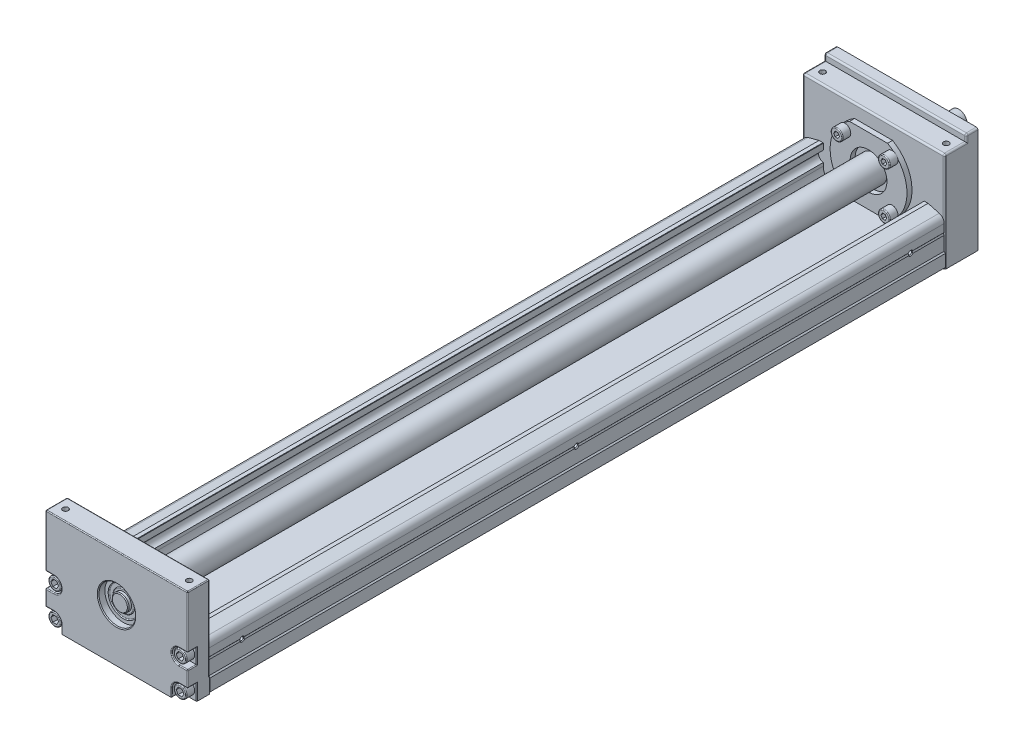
SolidWorks part; units mm, degrees
ref_plane "前视基准面" through (0, 0, 0) normal (0, 0, 1) x (1, 0, 0)
ref_plane "上视基准面" through (0, 0, 0) normal (0, 1, 0) x (1, 0, 0)
ref_plane "右视基准面" through (0, 0, 0) normal (1, 0, 0) x (0, 0, -1)
sketch "草图1" plane through (0, 0, 0) normal (0, 0, 1) x (1, 0, 0)
  line L0 (0, 0) -> (0, 14.97) construction
  line L1 (-11, 0.5) -> (11, 0.5)
  line L2 (11, 0.5) -> (11, 0)
  line L3 (11, 0) -> (33, 0) construction
  line L4 (33, 0) -> (33, 0.5)
  line L5 (33, 0.5) -> (41.5, 0.5)
  line L6 (43, 2) -> (43, 9.25) construction
  line L7 (43, 9.25) -> (42.25, 10)
  line L8 (42.25, 10) -> (42.25, 24.345)
  line L9 (39.2853, 28.2087) -> (32.6, 30)
  line L10 (32.6, 30) -> (30.1, 30) construction
  line L11 (30.1, 30) -> (30.1, 17.9)
  line L12 (30.1, 30) -> (30.1, 30.15)
  line L13 (13, 9.9) -> (-13, 9.9)
  line L14 (41.5, 0.5) -> (43, 2)
  line L15 (-41.5, 0.5) -> (-43, 2)
  line L16 (30.1, 30.15) -> (32.0402, 30.15)
  line L17 (-30.1, 30) -> (-30.1, 17.9)
  line L18 (-32.6, 30) -> (-30.1, 30) construction
  line L19 (-39.2853, 28.2087) -> (-32.6, 30)
  line L20 (-42.25, 10) -> (-42.25, 24.345)
  line L21 (-43, 9.25) -> (-42.25, 10)
  line L22 (-43, 2) -> (-43, 9.25) construction
  line L23 (-33, 0.5) -> (-41.5, 0.5)
  line L24 (-33, 0) -> (-33, 0.5)
  line L25 (-11, 0) -> (-33, 0) construction
  line L26 (-11, 0.5) -> (-11, 0)
  line L27 (13, 9.9) -> (22.1, 9.9)
  line L28 (32.0402, 30.15) -> (32.6, 30)
  line L29 (-13, 9.9) -> (-22.1, 9.9)
  line L30 (43, 9.25) -> (43.15, 9.1)
  line L31 (43.15, 9.1) -> (43.15, 2.15)
  line L32 (43.15, 2.15) -> (43, 2)
  line L33 (33, 0) -> (33, -0.5)
  line L34 (33, -0.5) -> (11, -0.5)
  line L35 (11, -0.5) -> (11, 0)
  line L36 (-11, -0.5) -> (-11, 0)
  line L37 (-33, -0.5) -> (-11, -0.5)
  line L38 (-33, 0) -> (-33, -0.5)
  line L39 (-43.15, 2.15) -> (-43, 2)
  line L40 (-43.15, 9.1) -> (-43.15, 2.15)
  line L41 (-43, 9.25) -> (-43.15, 9.1)
  line L42 (-30.1, 30) -> (-30.1, 30.15)
  line L43 (-30.1, 30.15) -> (-32.0402, 30.15)
  line L44 (-32.0402, 30.15) -> (-32.6, 30)
  arc A0 (42.25, 24.345) -> (39.2853, 28.2087) centre (38.25, 24.345) ccw
  arc A1 (-22.1, 9.9) -> (-30.1, 17.9) centre (-22.1, 17.9) cw
  arc A2 (22.1, 9.9) -> (30.1, 17.9) centre (22.1, 17.9) ccw
  arc A3 (-42.25, 24.345) -> (-39.2853, 28.2087) centre (-38.25, 24.345) cw
  point P9 (43, 0.5)
  point P24 (0, 0.5)
  point P25 (0, 9.9)
  point P40 (-43, 0.5)
  dimension "D16" = 4
  dimension "D17" = 13
  dimension "D15" = 8
  dimension "D1" = 0.5
  dimension "D2" = 0.5
  dimension "D3" = 43
  dimension "D4" = 42.25
  dimension "D5" = 2.5
  dimension "D6" = 30
  dimension "D7" = 15
  dimension "D8" = 9.4
  dimension "D9" = 22
  dimension "D10" = 11
  dimension "D11" = 10
  dimension "D12" = 45
  dimension "D13" = 30.1
  dimension "D14" = 13
  dimension "D19" = 22.1
  dimension "D20" = 22.1
  dimension "D21" = 0.5
  dimension "D22" = 0.15
  dimension "D23" = 0.15
extrude "总长" add sketch "草图1" along normal blind 440
sketch "草图2" plane through (0, 0, 0) normal (0, 0, -1) x (-1, 0, 0)
  line L0 (-33.1974, 23) -> (30.685, 23) construction
  line L1 (0, 0) -> (0, 24.2172) construction
  line L2 (-29.7, 23) -> (-31.9451, 25.2451) construction
  line L4 (-22.1, 9.9) -> (22.1, 9.9) construction
  line L5 (-30.1, 30.15) -> (-30.1, 17.9) construction
  line L6 (-32.8, 22.7) -> (-32.8, 23.3)
  line L7 (-32.6, 23.5) -> (-32.3495, 23.5)
  line L8 (-29.6116, 22.9116) -> (-32.6, 23.3) construction
  line L9 (-32.6, 23.3) -> (-32.8841, 23.3369) construction
  line L10 (-32.6, 22.5) -> (-32.3495, 22.5)
  line L11 (32.6, 22.5) -> (32.3495, 22.5)
  line L12 (32.8, 22.7) -> (32.8, 23.3)
  line L13 (32.6, 23.5) -> (32.3495, 23.5)
  circle A0 centre (-29.7, 23) radius 3.175 construction
  arc A1 (-26.3128, 23) -> (-32.9104, 23) centre (-29.6116, 22.9116) ccw construction
  arc A2 (-26.3128, 23) -> (-32.9104, 23) centre (-29.6116, 23.0884) cw construction
  arc A3 (26.3128, 23) -> (32.9104, 23) centre (29.6116, 23.0884) ccw construction
  arc A4 (26.3128, 23) -> (32.9104, 23) centre (29.6116, 22.9116) cw construction
  arc A5 (-32.3495, 22.5) -> (-32.3495, 23.5) centre (-29.9, 23) ccw
  arc A6 (-32.8, 23.3) -> (-32.6, 23.5) centre (-32.6, 23.3) cw
  arc A7 (-32.8, 22.7) -> (-32.6, 22.5) centre (-32.6, 22.7) ccw
  arc A8 (32.8, 22.7) -> (32.6, 22.5) centre (32.6, 22.7) cw
  arc A9 (32.8, 23.3) -> (32.6, 23.5) centre (32.6, 23.3) ccw
  arc A10 (32.3495, 22.5) -> (32.3495, 23.5) centre (29.9, 23) cw
  point P20 (-31.5649, 24.8649)
  point P21 (-30.1, 26.1753)
  point P22 (-30.1, 25.492)
  point P31 (-32.7983, 23.3258)
  point P33 (-32.8, 23)
  dimension "D2" = 6.35
  dimension "D5" = 6.6
  dimension "D6" = 5
  dimension "D10" = 0.2
  dimension "D1" = 13.1
  dimension "D3" = 59.4
  dimension "D4" = 45
  dimension "D7" = 59.8
  dimension "D8" = 0.5376
  dimension "D9" = 0.6833
  dimension "D11" = 1
  dimension "D12" = 65.6
  dimension "D13" = 0.0865
extrude "预拉滚道" cut sketch "草图2" against normal through all
hole_wizard "cekong" positions "草图4" profile "草图3" tap size "M2.5" standard "GB"
sketch "草图4" plane through (-42.25, 0, 0) normal (-1, 0, 0) x (0, 0, 1)
  line L2 (0, 24.345) -> (0, 10) construction
  point P0 (20, 19)
  dimension "D3" = 19
  dimension "ckdj" = 20
sketch "草图3" plane through (-42.25, 19, 20) normal (0, 1, 0) x (0, 0, 1)
  line L0 (0, 0) -> (0, 6.1159)
  line L1 (0, 6.1159) -> (1.025, 5.5)
  line L2 (1.025, 5.5) -> (1.025, 0.475)
  line L3 (1.025, 0.475) -> (1.5, 0)
  line L5 (1.5, 0) -> (0, 0)
  line L6 (-1.025, 0.475) -> (-1.5, 0) construction
  line L10 (0, 6.1159) -> (-1.025, 5.5) construction
  line L11 (0, -6.35) -> (0, 107.95) construction
  dimension "螺纹孔钻头直径" = 2.05
  dimension "螺纹孔钻头深度" = 5.5
  dimension "近端锥形沉头孔直径" = 3
  dimension "近端锥形沉头孔角度" = 90
  dimension "导头角度" = 118
pattern_linear "ckzl" count 3 spacing 200 along (0, 0, 1) of "cekong"
mirror "镜向3" about plane through (0, 0, 0) normal (1, 0, 0) of "ckzl", "cekong"
hole_wizard "dikong" positions "草图6" profile "草图5" counterbore size "M6" standard "GB"
sketch "草图6" plane through (6.505, 30.15, 0) normal (0, 1, 0) x (1, 0, 0)
  line L1 (15.595, 0) -> (-28.605, 0) construction
  point P0 (-29.505, -70)
  dimension "D2" = 23
  dimension "dkdj" = 70
sketch "草图5" plane through (-23, 30.15, 70) normal (1, 0, 0) x (0, 0, 1)
  line L0 (0, 0) -> (0, 30.65)
  line L1 (3.3, 29.95) -> (4, 30.65)
  line L2 (3.3, 29.95) -> (3.3, 25.65)
  line L3 (3.3, 25.65) -> (5.5, 25.65)
  line L4 (5.5, 25.65) -> (5.5, 0)
  line L5 (5.5, 0) -> (0, 0)
  line L11 (0, -6.35) -> (0, 107.95) construction
  line L12 (4, 30.65) -> (0, 30.65)
  line L13 (-3.3, 29.95) -> (-4, 30.65) construction
  dimension "通孔孔直径" = 6.6
  dimension "通孔孔深度" = 30.65
  dimension "柱形沉头孔直径" = 11
  dimension "柱形沉头孔深度" = 25.65
  dimension "远端锥形沉头孔直径" = 8
  dimension "远端锥形沉头孔角度" = 90
pattern_linear "dkzl" count 4 spacing 100 along (0, 0, 1) count 2 spacing 46 along (1, 0, 0) of "dikong"
ref_plane "基准面1" through (0, 0, 220) normal (0, 0, 1) x (1, 0, 0)
sketch "草图9" plane through (0, 0, 0) normal (0, 0, -1) x (-1, 0, 0)
  line L0 (42.25, 24.345) -> (42.25, 10) construction
  line L2 (0, 0) -> (0, 25.541) construction
  line L3 (36.1341, 19) -> (47.0239, 19) construction
  line L5 (40.5408, 6) -> (48.9402, 6) construction
  line L8 (42.7, 5.25) -> (51.3153, 5.25)
  line L9 (42.5, 5.45) -> (42.5, 6.55)
  line L10 (42.7, 6.75) -> (51.3153, 6.75)
  line L11 (51.3153, 5.25) -> (51.3153, 6.75)
  line L12 (42.5, 5.25) -> (51.3153, 6.75) construction
  line L13 (42.5, 6.75) -> (51.3153, 5.25) construction
  circle A0 centre (43.6, 6) radius 1 construction
  circle A1 centre (42.95, 19) radius 1
  circle A2 centre (-42.95, 19) radius 1
  arc A3 (42.7, 5.25) -> (42.5, 5.45) centre (42.7, 5.45) cw
  arc A4 (42.5, 6.55) -> (42.7, 6.75) centre (42.7, 6.55) cw
  point P20 (46.9077, 6)
  dimension "D1" = 2
  dimension "D4" = 2
  dimension "D8" = 0.2
  dimension "D2" = 87.2
  dimension "D3" = 13
  dimension "D5" = 0.7
  dimension "D6" = 1.5
  dimension "D7" = 85
extrude "标识槽" cut sketch "草图9" against normal through all
chamfer "倒角1" distance 0.35 angle 45 2 edges at (-30.1, 30.15, 220) (30.1, 30.15, 220)
chamfer "倒角2" distance 1 angle 45 4 edges at (-11, -0.5, 220) (-33, -0.5, 220) (11, -0.5, 220) (33, -0.5, 220)
sketch "草图11" plane through (0, 0, 0) normal (0, 0, -1) x (-1, 0, 0)
  line L0 (-32.0402, 30.15) -> (-30.45, 30.15) construction
  line L1 (-43, 30) -> (43, 30)
  line L2 (-43, 30) -> (-43, 0)
  line L3 (-43, 0) -> (43, 0)
  line L4 (43, 30) -> (43, 0)
  line L5 (-43.15, 2.15) -> (-43.15, 9.1) construction
  line L6 (43.15, 5.25) -> (43.15, 2.15) construction
  line L7 (32, -0.5) -> (12, -0.5) construction
  dimension "D1" = 0.15
  dimension "D2" = 0.15
  dimension "D3" = 0.15
  dimension "D4" = 0.5
extrude "切除-拉伸3" cut sketch "草图11" against normal through all flip side to cut
sketch "草图12" plane through (0, 0, 0) normal (0, 0, -1) x (-1, 0, 0)
  line L0 (0, 0) -> (0, 23) construction
  line L1 (0, 23) -> (-51.3359, 23) construction
  line L2 (-32.5, 0) -> (-11.5, 0) construction
  line L3 (-29.7, 23) -> (-31.9451, 25.2451)
  circle A0 centre (-29.7, 23) radius 3.175 construction
  arc A1 (-26.2025, 23) -> (-32.9281, 23) centre (-29.5653, 22.8653) ccw
  arc A2 (-26.2025, 23) -> (-32.9281, 23) centre (-29.5653, 23.1347) cw
  arc A3 (26.2025, 23) -> (32.9281, 23) centre (29.5653, 22.8653) cw
  arc A4 (26.2025, 23) -> (32.9281, 23) centre (29.5653, 23.1347) ccw
extrude "切除-拉伸4" cut sketch "草图12" against normal through all
sketch "草图13" plane through (0, 0, 0) normal (0, 0, -1) x (-1, 0, 0)
  line L0 (0, 0) -> (0, 45.4622) construction
  line L1 (-42.5, 64) -> (42.5, 64)
  line L2 (-42.5, 64) -> (-42.5, 0.5)
  line L3 (-42.5, 0.5) -> (42.5, 0.5)
  line L4 (42.5, 64) -> (42.5, 0.5)
  line L5 (11, 0.5) -> (-11, 0.5) construction
  dimension "D1" = 85
  dimension "D2" = 63.5
extrude "凸台-拉伸1" add sketch "草图13" along normal blind 87 separate body
sketch "草图15" plane through (42.5, 0, 0) normal (1, 0, 0) x (0, 0, -1)
  line L1 (15, 0.5) -> (73, 0.5)
  line L2 (23, 30.5) -> (23, 49.5)
  line L3 (23, 49.5) -> (73, 49.5)
  line L4 (73, 0.5) -> (73, 49.5)
  line L5 (0, 64) -> (0, 0.5) construction
  line L6 (15, 0.5) -> (15, 30.5)
  line L7 (15, 30.5) -> (23, 30.5)
  line L8 (87, 0.5) -> (0, 0.5) construction
  line L9 (23, 0.5) -> (23, 49.5) construction
  line L10 (15, 30.5) -> (73, 30.5) construction
  line L11 (15, 0.5) -> (15, 49.5) construction
  dimension "D1" = 23
  dimension "D2" = 50
  dimension "D3" = 49
  dimension "D4" = 8
  dimension "D5" = 30
extrude "切除-拉伸5" cut sketch "草图15" against normal blind 17.5
sketch "草图16" plane through (-42.5, 0, 0) normal (-1, 0, 0) x (0, 0, 1)
  line L6 (-73, 49.5) -> (-73, 0.5)
  line L7 (-23, 49.5) -> (-73, 49.5)
  line L8 (-23, 30.5) -> (-23, 49.5)
  line L9 (-15, 30.5) -> (-23, 30.5)
  line L10 (-15, 0.5) -> (-15, 30.5)
  line L11 (-73, 0.5) -> (-15, 0.5)
  line L12 (-73, 49.5) -> (-73, 0.5)
  line L13 (-23, 49.5) -> (-73, 49.5)
  line L14 (-23, 30.5) -> (-23, 49.5)
  line L15 (-15, 30.5) -> (-23, 30.5)
  line L16 (-15, 0.5) -> (-15, 30.5)
  line L17 (-73, 0.5) -> (-15, 0.5)
  dimension "D1" = 0
extrude "切除-拉伸6" cut sketch "草图16" against normal blind 17.5
sketch "草图18" plane through (0, 0, -87) normal (0, 0, -1) x (-1, 0, 0)
  line L0 (0, 0) -> (0, 32) construction
  circle A0 centre (0, 32) radius 23
  dimension "D1" = 46
  dimension "D2" = 32
extrude "切除-拉伸7" cut sketch "草图18" against normal blind 64
sketch "草图19" plane through (0, 0, -87) normal (0, 0, -1) x (-1, 0, 0)
  circle A0 centre (0, 32) radius 25
  dimension "D1" = 50
extrude "切除-拉伸8" cut sketch "草图19" against normal blind 3.5
sketch "草图20" plane through (0, 64, 0) normal (0, 1, 0) x (1, 0, 0)
  line L0 (0, 87) -> (0, -17.8608) construction
  line L1 (-42.5, 87) -> (42.5, 87) construction
  line L2 (-25, 73) -> (-42.5, 73) construction
  line L3 (-30, 73) -> (30, 73)
  line L4 (-30, 73) -> (-30, 23)
  line L5 (-30, 23) -> (30, 23)
  line L6 (30, 73) -> (30, 23)
  line L7 (23, 23) -> (-23, 23) construction
  dimension "D1" = 60
extrude "切除-拉伸9" cut sketch "草图20" against normal blind 43
fillet "圆角1" radius 3 6 edges at (-30, 56.75, -23) (-30, 56.75, -73) (30, 56.75, -73) (30, 56.75, -23) (-33.75, 30.5, -23) (33.75, 30.5, -23)
fillet "圆角2" radius 5 6 edges at (33.75, 30.5, -15) (34.75, 49.5, -73) (-34.75, 49.5, -73) (-33.75, 30.5, -15) (-34.75, 49.5, -23) (34.75, 49.5, -23)
sketch "草图22" plane through (42.5, 0, 0) normal (1, 0, 0) x (0, 0, -1)
  line L1 (0, 64) -> (13, 64)
  line L2 (0, 64) -> (0, 60)
  line L3 (0, 60) -> (13, 60)
  line L4 (13, 64) -> (13, 60)
  dimension "D1" = 13
  dimension "D2" = 4
extrude "切除-拉伸10" cut sketch "草图22" against normal through all
sketch "草图23" plane through (0, 0, -23) normal (0, 0, -1) x (-1, 0, 0)
  circle A0 centre (0, 32) radius 11
  dimension "D1" = 22
extrude "切除-拉伸11" cut sketch "草图23" against normal blind 5.5
sketch "草图24" plane through (0, 0, -17.5) normal (0, 0, -1) x (-1, 0, 0)
  circle A0 centre (0, 32) radius 8.5
  dimension "D1" = 17
extrude "凸台-拉伸3" add sketch "草图24" along normal blind 6
sketch "草图25" plane through (0, 0, -23.5) normal (0, 0, -1) x (-1, 0, 0)
  circle A0 centre (0, 32) radius 6
  dimension "D1" = 12
extrude "凸台-拉伸4" add sketch "草图25" along normal blind 7.5
sketch "草图26" plane through (0, 0, -23.5) normal (0, 0, -1) x (-1, 0, 0)
  line L0 (0, 45.435) -> (0, 32) construction
  line L1 (-2.7964, 42.6386) -> (-10.6386, 34.7964)
  line L2 (-10.6386, 29.2036) -> (-2.7964, 21.3614)
  line L3 (2.7964, 21.3614) -> (10.6386, 29.2036)
  line L4 (10.6386, 34.7964) -> (2.7964, 42.6386)
  circle A0 centre (0, 32) radius 9.5 construction
  arc A1 (-10.6386, 34.7964) -> (-10.6386, 29.2036) centre (0, 32) ccw
  arc A4 (-2.7964, 21.3614) -> (2.7964, 21.3614) centre (0, 32) ccw
  arc A5 (10.6386, 29.2036) -> (10.6386, 34.7964) centre (0, 32) ccw
  arc A6 (2.7964, 42.6386) -> (-2.7964, 42.6386) centre (0, 32) ccw
  point P14 (-1.5, 41)
  point P15 (-1.5, 21)
  point P18 (1.5, 41)
  point P19 (1.5, 21)
  dimension "D1" = 19
  dimension "D2" = 22
extrude "凸台-拉伸5" add sketch "草图26" along normal blind 6.5 separate body
sketch "草图27" plane through (0, 0, -31) normal (0, 0, -1) x (-1, 0, 0)
  circle A0 centre (0, 32) radius 5
  dimension "D1" = 10
extrude "凸台-拉伸6" add sketch "草图27" along normal blind 20
fillet "圆角3" radius 1 38 edges at (42.5, 13, -15) (42.5, 29.0355, -16.4645) (42.5, 31.3787, -22.1213) (42.5, 39, -23) (42.5, 48.0355, -24.4645) (42.5, 49.5, -48) (42.5, 48.0355, -71.5355) (-42.5, 13, -15) (-42.5, 29.0355, -16.4645) (-42.5, 31.3787, -22.1213) (-42.5, 39, -23) (-42.5, 48.0355, -24.4645) (-42.5, 49.5, -48) (-42.5, 48.0355, -71.5355) (-42.5, 30.25, 0) (42.5, 30.25, 0) (-42.5, 0.5, -80) (42.5, 0.5, -80) (0, 0.5, -87) (42.5, 22.5, -73) (42.5, 32.25, -87) (-42.5, 22.5, -73) (-42.5, 32.25, -87) (42.5, 60, -6.5) (42.5, 62, -13) (0, 60, 0) (0, 64, -13) (-42.5, 62, -13) (-42.5, 60, -6.5) (-42.5, 64, -50) (0, 64, -87) (42.5, 64, -50) (-33.75, 0.5, -15) (-25, 0.5, -44) (-33.75, 0.5, -73) (33.75, 0.5, -73) (25, 0.5, -44) (33.75, 0.5, -15)
sketch "草图28" plane through (0, 0, 440) normal (0, 0, 1) x (1, 0, 0)
  line L0 (-41.5, 0.5) -> (-33, 0.5) construction
  line L1 (-42.5, 0.5) -> (42.5, 0.5)
  line L2 (-42.5, 0.5) -> (-42.5, 60)
  line L3 (-42.5, 60) -> (42.5, 60)
  line L4 (42.5, 0.5) -> (42.5, 60)
  line L5 (-42.5, 0.5) -> (-42.5, 59) construction
  line L6 (-41.5, 60) -> (41.5, 60) construction
  line L7 (42.5, 59) -> (42.5, 0.5) construction
extrude "凸台-拉伸7" add sketch "草图28" along normal blind 13
hole_wizard "M4 螺纹孔1" positions "草图30" profile "草图29" tap size "M4" standard "GB"
sketch "草图30" plane through (0, 60, 0) normal (0, 1, 0) x (1, 0, 0)
  line L0 (0, 86) -> (0, -453) construction
  line L1 (41.5, 86) -> (-41.5, 86) construction
  line L2 (42.5, -453) -> (-42.5, -453) construction
  line L4 (-41.5, 13) -> (41.5, 13) construction
  point P0 (-37, -446.5)
  point P2 (37, -446.5)
  point P4 (-37, 6.5)
  point P6 (37, 6.5)
  dimension "D1" = 74
  dimension "D2" = 6.5
  dimension "D3" = 6.5
sketch "草图29" plane through (-37, 60, 446.5) normal (1, 0, 0) x (0, 0, 1)
  line L0 (0, 0) -> (0, 11.0914)
  line L1 (0, 11.0914) -> (1.65, 10.1)
  line L2 (1.65, 10.1) -> (1.65, 0)
  line L5 (1.65, 0) -> (0, 0)
  line L10 (0, 11.0914) -> (-1.65, 10.1) construction
  line L11 (0, -6.35) -> (0, 107.95) construction
  dimension "螺纹孔钻头直径" = 3.3
  dimension "螺纹孔钻头深度" = 10.1
  dimension "导头角度" = 118
sketch "草图32" plane through (0, 0, 0) normal (0, 0, 1) x (1, 0, 0)
  circle A0 centre (0, 32) radius 8
  dimension "D1" = 16
extrude "凸台-拉伸8" add sketch "草图32" along normal up to surface (440 mm away)
sketch "草图33" plane through (0, 0, 453) normal (0, 0, 1) x (1, 0, 0)
  circle A0 centre (0, 32) radius 11
extrude "切除-拉伸12" cut sketch "草图33" against normal blind 4
sketch "草图34" plane through (0, 0, 449) normal (0, 0, 1) x (1, 0, 0)
  circle A0 centre (0, 32) radius 5
  dimension "D1" = 10
extrude "凸台-拉伸9" add sketch "草图34" along normal blind 2
sketch "草图35" plane through (0, 0, 453) normal (0, 0, 1) x (1, 0, 0)
  line L0 (0, 32) -> (0, 0) construction
  line L1 (-11.5, 0) -> (-32.5, 0) construction
  line L2 (-42.5, 60) -> (-42.5, 0.5) construction
  line L3 (42.5, 0.5) -> (42.5, 60) construction
  line L4 (-42.5, 28.5) -> (-42.5, 19.5)
  line L5 (42.5, 0.5) -> (42.5, 10)
  line L6 (-37.5, 28.5) -> (-42.5, 28.5)
  line L7 (-37.5, 19.5) -> (-42.5, 19.5)
  line L8 (-37.5, 10) -> (-42.5, 10)
  line L9 (-33, 5.5) -> (-33, 0.5)
  line L10 (-42.5, 0.5) -> (-33, 0.5)
  line L11 (-42.5, 10) -> (-42.5, 0.5)
  line L12 (37.5, 28.5) -> (42.5, 28.5)
  line L13 (37.5, 19.5) -> (42.5, 19.5)
  line L14 (37.5, 10) -> (42.5, 10)
  line L15 (33, 5.5) -> (33, 0.5)
  line L16 (33, 0.5) -> (42.5, 0.5)
  line L17 (-42.5, 0.5) -> (42.5, 0.5) construction
  line L18 (42.5, 19.5) -> (42.5, 28.5)
  arc A0 (-37.5, 19.5) -> (-37.5, 28.5) centre (-37.5, 24) ccw
  arc A1 (-33, 5.5) -> (-37.5, 10) centre (-37.5, 5.5) ccw
  arc A2 (37.5, 28.5) -> (37.5, 19.5) centre (37.5, 24) ccw
  arc A3 (37.5, 10) -> (33, 5.5) centre (37.5, 5.5) ccw
  dimension "D1" = 75
  dimension "D2" = 5.5
  dimension "D3" = 18.5
  dimension "D4" = 9
extrude "切除-拉伸13" cut sketch "草图35" against normal blind 5.5
sketch "草图36" plane through (0, 0, 447.5) normal (0, 0, 1) x (1, 0, 0)
  circle A0 centre (-37.5, 24) radius 3.75
  circle A1 centre (-37.5, 5.5) radius 3.75
  circle A2 centre (37.5, 5.5) radius 3.75
  circle A3 centre (37.5, 24) radius 3.75
  dimension "D1" = 7.5
extrude "凸台-拉伸10" add sketch "草图36" along normal blind 5
sketch "草图37" plane through (0, 0, 452.5) normal (0, 0, 1) x (1, 0, 0)
  line L1 (-36.3453, 26) -> (-38.6547, 26)
  line L2 (-38.6547, 26) -> (-39.8094, 24)
  line L3 (-39.8094, 24) -> (-38.6547, 22)
  line L4 (-38.6547, 22) -> (-36.3453, 22)
  line L5 (-36.3453, 22) -> (-35.1906, 24)
  line L6 (-35.1906, 24) -> (-36.3453, 26)
  line L7 (-36.3453, 7.5) -> (-38.6547, 7.5)
  line L8 (-38.6547, 7.5) -> (-39.8094, 5.5)
  line L9 (-39.8094, 5.5) -> (-38.6547, 3.5)
  line L10 (-38.6547, 3.5) -> (-36.3453, 3.5)
  line L11 (-36.3453, 3.5) -> (-35.1906, 5.5)
  line L12 (-35.1906, 5.5) -> (-36.3453, 7.5)
  line L13 (36.3453, 7.5) -> (35.1906, 5.5)
  line L14 (35.1906, 5.5) -> (36.3453, 3.5)
  line L15 (36.3453, 3.5) -> (38.6547, 3.5)
  line L16 (38.6547, 3.5) -> (39.8094, 5.5)
  line L17 (39.8094, 5.5) -> (38.6547, 7.5)
  line L18 (38.6547, 7.5) -> (36.3453, 7.5)
  line L19 (36.3453, 26) -> (35.1906, 24)
  line L20 (35.1906, 24) -> (36.3453, 22)
  line L21 (36.3453, 22) -> (38.6547, 22)
  line L22 (38.6547, 22) -> (39.8094, 24)
  line L23 (39.8094, 24) -> (38.6547, 26)
  line L24 (38.6547, 26) -> (36.3453, 26)
  circle A0 centre (-37.5, 24) radius 2 construction
  circle A1 centre (-37.5, 5.5) radius 2 construction
  circle A2 centre (37.5, 5.5) radius 2 construction
  circle A3 centre (37.5, 24) radius 2 construction
  dimension "D1" = 4
extrude "切除-拉伸14" cut sketch "草图37" against normal blind 3.5
fillet "圆角4" radius 0.5 39 edges at (40, 28.5, 453) (33, 24, 453) (33, 3, 453) (34.318, 8.682, 453) (-33, 3, 453) (-40, 10, 453) (-40, 28.5, 453) (-33, 24, 453) (-42.5, 34.875, 440) (42.5, 34.875, 440) (42.5, 14.75, 453) (42.5, 44.25, 453) (42.5, 60, 446.5) (0, 60, 440) (-42.5, 60, 446.5) (0, 60, 453) (-42.5, 19.5, 450.25) (-42.5, 24, 447.5) (-42.5, 28.5, 450.25) (33, 0.5, 450.25) (42.5, 10, 450.25) (42.5, 5.25, 447.5) (42.5, 19.5, 450.25) (42.5, 24, 447.5) (42.5, 28.5, 450.25) (-33, 0.5, 450.25) (-37.75, 0.5, 447.5) (-42.5, 5.25, 447.5) (-42.5, 10, 450.25) (-42.5, 14.75, 453) (-42.5, 44.25, 453) (41.25, 24, 452.5) (40, 19.5, 453) (40, 10, 453) (41.25, 5.5, 452.5) (-34.318, 8.682, 453) (-40, 19.5, 453) (-33.75, 24, 452.5) (-33.75, 5.5, 452.5)
sketch "草图38" plane through (0, 0, -87) normal (0, 0, -1) x (-1, 0, 0)
  circle A0 centre (-37.5, 24) radius 2.25
  circle A1 centre (-37.5, 5.5) radius 2.25
  circle A2 centre (37.5, 5.5) radius 2.25
  circle A3 centre (37.5, 24) radius 2.25
  dimension "D1" = 4.5
extrude "切除-拉伸15" cut sketch "草图38" against normal blind 23.5
sketch "草图39" plane through (0, 0, -15) normal (0, 0, -1) x (-1, 0, 0)
  circle A0 centre (37.5, 24) radius 3.75 construction
  circle A1 centre (37.5, 5.5) radius 3.75 construction
  circle A2 centre (-37.5, 24) radius 3.75 construction
  circle A3 centre (-37.5, 5.5) radius 3.75 construction
  circle A4 centre (37.5, 24) radius 3.75
  circle A5 centre (37.5, 5.5) radius 3.75
  circle A6 centre (-37.5, 24) radius 3.75
  circle A7 centre (-37.5, 5.5) radius 3.75
extrude "凸台-拉伸11" add sketch "草图39" along normal blind 5
sketch "草图40" plane through (0, 0, -20) normal (0, 0, -1) x (-1, 0, 0)
  line L0 (35.1906, 24) -> (36.3453, 26) construction
  line L1 (36.3453, 26) -> (38.6547, 26) construction
  line L2 (38.6547, 26) -> (39.8094, 24) construction
  line L3 (39.8094, 24) -> (38.6547, 22) construction
  line L4 (38.6547, 22) -> (36.3453, 22) construction
  line L5 (36.3453, 22) -> (35.1906, 24) construction
  line L6 (35.1906, 5.5) -> (36.3453, 7.5) construction
  line L7 (36.3453, 7.5) -> (38.6547, 7.5) construction
  line L8 (38.6547, 7.5) -> (39.8094, 5.5) construction
  line L9 (39.8094, 5.5) -> (38.6547, 3.5) construction
  line L10 (38.6547, 3.5) -> (36.3453, 3.5) construction
  line L11 (36.3453, 3.5) -> (35.1906, 5.5) construction
  line L12 (-38.6547, 26) -> (-36.3453, 26) construction
  line L13 (-36.3453, 26) -> (-35.1906, 24) construction
  line L14 (-35.1906, 24) -> (-36.3453, 22) construction
  line L15 (-36.3453, 22) -> (-38.6547, 22) construction
  line L16 (-38.6547, 22) -> (-39.8094, 24) construction
  line L17 (-39.8094, 24) -> (-38.6547, 26) construction
  line L18 (-38.6547, 7.5) -> (-36.3453, 7.5) construction
  line L19 (-36.3453, 7.5) -> (-35.1906, 5.5) construction
  line L20 (-35.1906, 5.5) -> (-36.3453, 3.5) construction
  line L21 (-36.3453, 3.5) -> (-38.6547, 3.5) construction
  line L22 (-38.6547, 3.5) -> (-39.8094, 5.5) construction
  line L23 (-39.8094, 5.5) -> (-38.6547, 7.5) construction
  line L24 (35.1906, 24) -> (36.3453, 26)
  line L25 (36.3453, 26) -> (38.6547, 26)
  line L26 (38.6547, 26) -> (39.8094, 24)
  line L27 (39.8094, 24) -> (38.6547, 22)
  line L28 (38.6547, 22) -> (36.3453, 22)
  line L29 (36.3453, 22) -> (35.1906, 24)
  line L30 (35.1906, 5.5) -> (36.3453, 7.5)
  line L31 (36.3453, 7.5) -> (38.6547, 7.5)
  line L32 (38.6547, 7.5) -> (39.8094, 5.5)
  line L33 (39.8094, 5.5) -> (38.6547, 3.5)
  line L34 (38.6547, 3.5) -> (36.3453, 3.5)
  line L35 (36.3453, 3.5) -> (35.1906, 5.5)
  line L36 (-38.6547, 26) -> (-36.3453, 26)
  line L37 (-36.3453, 26) -> (-35.1906, 24)
  line L38 (-35.1906, 24) -> (-36.3453, 22)
  line L39 (-36.3453, 22) -> (-38.6547, 22)
  line L40 (-38.6547, 22) -> (-39.8094, 24)
  line L41 (-39.8094, 24) -> (-38.6547, 26)
  line L42 (-38.6547, 7.5) -> (-36.3453, 7.5)
  line L43 (-36.3453, 7.5) -> (-35.1906, 5.5)
  line L44 (-35.1906, 5.5) -> (-36.3453, 3.5)
  line L45 (-36.3453, 3.5) -> (-38.6547, 3.5)
  line L46 (-38.6547, 3.5) -> (-39.8094, 5.5)
  line L47 (-39.8094, 5.5) -> (-38.6547, 7.5)
extrude "切除-拉伸16" cut sketch "草图40" against normal blind 3
fillet "圆角5" radius 0.5 4 edges at (-37.5, 27.75, -20) (-37.5, 9.25, -20) (37.5, 9.25, -20) (37.5, 27.75, -20)
hole_wizard "M4 螺纹孔2" positions "草图42" profile "草图41" tap size "M4" standard "GB"
sketch "草图42" plane through (0, 0, -87) normal (0, 0, -1) x (-1, 0, 0)
  line L0 (-25, 32) -> (0, 32) construction
  line L1 (0, 32) -> (0, 57) construction
  line L3 (-25.9808, 47) -> (25.9808, 17) construction
  line L5 (25.9808, 47) -> (-25.9808, 17) construction
  circle A0 centre (0, 32) radius 25 construction
  circle A1 centre (0, 32) radius 25 construction
  circle A2 centre (0, 32) radius 30
  point P0 (-25.9808, 47)
  point P2 (-25.9808, 17)
  point P4 (25.9808, 17)
  point P6 (25.9808, 47)
  dimension "D1" = 30
  dimension "D3" = 60
  dimension "D2" = 30
sketch "草图41" plane through (25.9808, 47, -87) normal (1, 0, 0) x (0, 1, 0)
  line L0 (0, 0) -> (0, 11.0914)
  line L1 (0, 11.0914) -> (1.65, 10.1)
  line L2 (1.65, 10.1) -> (1.65, 0)
  line L5 (1.65, 0) -> (0, 0)
  line L10 (0, 11.0914) -> (-1.65, 10.1) construction
  line L11 (0, -6.35) -> (0, 107.95) construction
  dimension "螺纹孔钻头直径" = 3.3
  dimension "螺纹孔钻头深度" = 10.1
  dimension "导头角度" = 118
hole_wizard "M5 螺纹孔1" positions "草图44" profile "草图43" tap size "M5" standard "GB"
sketch "草图44" plane through (0, 0, -87) normal (0, 0, -1) x (-1, 0, 0)
  line L0 (0, 67) -> (0, 32) construction
  line L1 (0, 32) -> (-35, 32) construction
  line L3 (-24.7487, 56.7487) -> (24.7487, 7.2513) construction
  line L5 (24.7487, 56.7487) -> (-24.7487, 7.2513) construction
  circle A0 centre (0, 32) radius 35 construction
  point P0 (-24.7487, 56.7487)
  point P14 (24.7487, 7.2513)
  point P17 (24.7487, 56.7487)
  point P18 (-24.7487, 7.2513)
  dimension "D1" = 45
  dimension "D3" = 70
  dimension "D2" = 45
sketch "草图43" plane through (24.7487, 56.7487, -87) normal (1, 0, 0) x (0, 1, 0)
  line L0 (0, 0) -> (0, 13.6618)
  line L1 (0, 13.6618) -> (2.1, 12.4)
  line L2 (2.1, 12.4) -> (2.1, 0)
  line L5 (2.1, 0) -> (0, 0)
  line L10 (0, 13.6618) -> (-2.1, 12.4) construction
  line L11 (0, -6.35) -> (0, 107.95) construction
  dimension "螺纹孔钻头直径" = 4.2
  dimension "螺纹孔钻头深度" = 12.4
  dimension "导头角度" = 118
sketch "草图45" plane through (0, 0.5, 0) normal (0, -1, 0) x (1, 0, 0)
  line L0 (0, -87) -> (0, 0) construction
  line L1 (41.5, -87) -> (-41.5, -87) construction
  line L2 (-25, -44) -> (25, -44) construction
  line L3 (-25, -73) -> (-25, -15) construction
  line L4 (25, -15) -> (25, -73) construction
  line L6 (-18, -28) -> (18, -28)
  line L7 (-21, -31) -> (-21, -57)
  line L8 (-18, -60) -> (18, -60)
  line L9 (21, -31) -> (21, -57)
  arc A0 (21, -31) -> (18, -28) centre (18, -31) ccw
  arc A1 (18, -60) -> (21, -57) centre (18, -57) ccw
  arc A2 (-18, -60) -> (-21, -57) centre (-18, -57) cw
  arc A3 (-21, -31) -> (-18, -28) centre (-18, -31) cw
  dimension "D1" = 3
  dimension "D2" = 32
  dimension "D3" = 42
extrude "切除-拉伸17" cut sketch "草图45" against normal blind 0.5
sketch "草图46" plane through (0, 1, 0) normal (0, -1, 0) x (1, 0, 0)
  line L0 (-21, -31) -> (-21, -57) construction
  line L1 (-18, -60) -> (18, -60) construction
  text T0 "KKR86" font "汉仪长仿宋体" height in points 42
  dimension "D1" = 6
  dimension "D2" = 10
extrude "凸台-拉伸12" add sketch "草图46" along normal blind 0.5
sketch "草图47" plane through (0, 0, 0) normal (0, 0, 1) x (1, 0, 0)
  line L0 (-23, 32) -> (23, 32) construction
  line L1 (-11.3578, 12) -> (11.3578, 12)
  line L2 (-11.3578, 52) -> (11.3578, 52)
  line L4 (-23, 52) -> (23, 52) construction
  line L5 (-23, 12) -> (23, 12) construction
  arc A0 (-11.3578, 52) -> (-11.3578, 12) centre (0, 32) ccw
  arc A1 (11.3578, 12) -> (11.3578, 52) centre (0, 32) ccw
  circle A2 centre (0, 32) radius 11
  dimension "D1" = 20
  dimension "D3" = 23
  dimension "D4" = 22
  dimension "D2" = 20
extrude "凸台-拉伸13" add sketch "草图47" along normal blind 3
sketch "草图48" plane through (0, 0, 3) normal (0, 0, 1) x (1, 0, 0)
  line L0 (0, 52) -> (0, 32) construction
  line L1 (0, 32) -> (-20, 32) construction
  line L2 (-14.1421, 46.1421) -> (14.1421, 17.8579) construction
  line L3 (14.1421, 46.1421) -> (-14.1421, 17.8579) construction
  circle A0 centre (0, 32) radius 20 construction
  circle A1 centre (-14.1421, 46.1421) radius 3.5
  circle A2 centre (14.1421, 46.1421) radius 3.5
  circle A3 centre (14.1421, 17.8579) radius 3.5
  circle A4 centre (-14.1421, 17.8579) radius 3.5
  dimension "D1" = 40
  dimension "D4" = 7
  dimension "D2" = 45
  dimension "D3" = 45
extrude "凸台-拉伸14" add sketch "草图48" along normal blind 5
sketch "草图49" plane through (0, 0, 8) normal (0, 0, 1) x (1, 0, 0)
  line L1 (-12.4101, 46.1421) -> (-13.2761, 47.6421)
  line L2 (-13.2761, 47.6421) -> (-15.0082, 47.6421)
  line L3 (-15.0082, 47.6421) -> (-15.8742, 46.1421)
  line L4 (-15.8742, 46.1421) -> (-15.0082, 44.6421)
  line L5 (-15.0082, 44.6421) -> (-13.2761, 44.6421)
  line L6 (-13.2761, 44.6421) -> (-12.4101, 46.1421)
  line L7 (15.0082, 47.6421) -> (13.2761, 47.6421)
  line L8 (13.2761, 47.6421) -> (12.4101, 46.1421)
  line L9 (12.4101, 46.1421) -> (13.2761, 44.6421)
  line L10 (13.2761, 44.6421) -> (15.0082, 44.6421)
  line L11 (15.0082, 44.6421) -> (15.8742, 46.1421)
  line L12 (15.8742, 46.1421) -> (15.0082, 47.6421)
  line L13 (13.2761, 19.3579) -> (12.4101, 17.8579)
  line L14 (12.4101, 17.8579) -> (13.2761, 16.3579)
  line L15 (13.2761, 16.3579) -> (15.0082, 16.3579)
  line L16 (15.0082, 16.3579) -> (15.8742, 17.8579)
  line L17 (15.8742, 17.8579) -> (15.0082, 19.3579)
  line L18 (15.0082, 19.3579) -> (13.2761, 19.3579)
  line L19 (-13.2761, 19.3579) -> (-15.0082, 19.3579)
  line L20 (-15.0082, 19.3579) -> (-15.8742, 17.8579)
  line L21 (-15.8742, 17.8579) -> (-15.0082, 16.3579)
  line L22 (-15.0082, 16.3579) -> (-13.2761, 16.3579)
  line L23 (-13.2761, 16.3579) -> (-12.4101, 17.8579)
  line L24 (-12.4101, 17.8579) -> (-13.2761, 19.3579)
  circle A0 centre (-14.1421, 46.1421) radius 1.5 construction
  circle A1 centre (14.1421, 46.1421) radius 1.5 construction
  circle A2 centre (14.1421, 17.8579) radius 1.5 construction
  circle A3 centre (-14.1421, 17.8579) radius 1.5 construction
  dimension "D1" = 3
extrude "切除-拉伸18" cut sketch "草图49" against normal blind 3
fillet "圆角6" radius 0.5 4 edges at (17.6421, 17.8579, 8) (-10.6421, 17.8579, 8) (17.6421, 46.1421, 8) (-10.6421, 46.1421, 8)
sketch "草图50" plane through (0, 0, 449) normal (0, 0, 1) x (1, 0, 0)
  circle A0 centre (0, 32) radius 6.5
  circle A1 centre (0, 32) radius 9
  dimension "D1" = 13
  dimension "D2" = 18
extrude "切除-拉伸19" cut sketch "草图50" against normal blind 0.5
chamfer "倒角3" distance 0.5 angle 45 2 edges at (5, 32, 451) (11, 32, 453)
fillet "圆角7" radius 0.5 2 edges at (6.5, 32, 449) (9, 32, 448.5)
hole_wizard "Ø8.0 (8) 直径孔1" positions "草图52" profile "草图51" hole size "Ø8.0" standard "ISO"
sketch "草图52" plane through (0, 0, 440) normal (0, 0, -1) x (-1, 0, 0)
  circle A0 centre (0, 32) radius 8 construction
  point P0 (-17, 40)
  dimension "D1" = 17
  dimension "D2" = 8
sketch "草图51" plane through (17, 40, 440) normal (1, 0, 0) x (0, 1, 0)
  line L0 (0, 0) -> (0, 10.4034)
  line L1 (0, 10.4034) -> (4, 8)
  line L2 (4, 8) -> (4, 0.5)
  line L3 (4, 0.5) -> (4.5, 0)
  line L5 (4.5, 0) -> (0, 0)
  line L6 (-4, 0.5) -> (-4.5, 0) construction
  line L10 (0, 10.4034) -> (-4, 8) construction
  line L11 (0, -6.35) -> (0, 107.95) construction
  dimension "孔直径" = 8
  dimension "孔深度" = 8
  dimension "近端锥形沉头孔直径" = 9
  dimension "近端锥形沉头孔角度" = 90
  dimension "导头角度" = 118
sketch "草图53" plane through (0, 0, -87) normal (0, 0, -1) x (-1, 0, 0)
  line L1 (-45.1515, 66.1108) -> (56.8513, 66.1108)
  line L2 (-45.1515, 66.1108) -> (-45.1515, -7.0544)
  line L3 (-45.1515, -7.0544) -> (56.8513, -7.0544)
  line L4 (56.8513, 66.1108) -> (56.8513, -7.0544)
  circle A0 centre (0, 32) radius 23 construction
  circle A1 centre (0, 32) radius 23
extrude "切除-拉伸20" cut sketch "草图53" against normal up to surface (64 mm away)
sketch "草图54" plane through (0, 0, -23) normal (0, 0, -1) x (-1, 0, 0)
  line L1 (-47.5859, 65.4722) -> (50.1607, 65.4722)
  line L2 (-47.5859, 65.4722) -> (-47.5859, -2.1398)
  line L3 (-47.5859, -2.1398) -> (50.1607, -2.1398)
  line L4 (50.1607, 65.4722) -> (50.1607, -2.1398)
  circle A0 centre (0, 32) radius 20
  dimension "D1" = 40
extrude "切除-拉伸21" cut sketch "草图54" against normal blind 3
sketch "草图55" plane through (0, 0, -20) normal (0, 0, -1) x (-1, 0, 0)
  line L0 (-42.5, 63) -> (-42.5, 31.5) construction
  line L1 (-42.5, 37.531) -> (-22, 37.531)
  line L2 (-42.5, 37.531) -> (-42.5, 0.5)
  line L3 (-42.5, 0.5) -> (-22, 0.5)
  line L4 (-22, 37.531) -> (-22, 0.5)
  line L5 (-33, 0.5) -> (-11, 0.5) construction
  line L6 (42.5, 31.5) -> (42.5, 63) construction
  line L7 (42.5, 39.3429) -> (21.2658, 39.3429)
  line L8 (42.5, 39.3429) -> (42.5, 0.5)
  line L9 (42.5, 0.5) -> (21.2658, 0.5)
  line L10 (21.2658, 39.3429) -> (21.2658, 0.5)
  line L11 (-24, 0.5) -> (24, 0.5) construction
  circle A0 centre (-37.5, 24) radius 4.25
  circle A1 centre (-37.5, 5.5) radius 4.25
  circle A2 centre (37.5, 24) radius 4.25
  circle A3 centre (37.5, 5.5) radius 4.25
  dimension "D1" = 8.5
extrude "凸台-拉伸15" add sketch "草图55" against normal blind 10
hole_wizard "M5 螺纹孔2" positions "草图57" profile "草图56" tap size "M5" standard "GB"
sketch "草图57" plane through (0, 0, -20) normal (0, 0, -1) x (-1, 0, 0)
  line L0 (0, 32) -> (0, 67.0171) construction
  line L2 (0, 32) -> (-30.783, 32) construction
  point P0 (-20, 52)
  point P2 (20, 52)
  point P4 (20, 12)
  point P6 (-20, 12)
  dimension "D1" = 40
  dimension "D2" = 40
sketch "草图56" plane through (20, 52, -20) normal (1, 0, 0) x (0, 1, 0)
  line L0 (0, 0) -> (0, 13.6618)
  line L1 (0, 13.6618) -> (2.1, 12.4)
  line L2 (2.1, 12.4) -> (2.1, 0)
  line L5 (2.1, 0) -> (0, 0)
  line L10 (0, 13.6618) -> (-2.1, 12.4) construction
  line L11 (0, -6.35) -> (0, 107.95) construction
  dimension "螺纹孔钻头直径" = 4.2
  dimension "螺纹孔钻头深度" = 12.4
  dimension "导头角度" = 118
hole_wizard "M5 螺纹孔3" positions "草图58" profile "草图61" tap size "M5" standard "GB"
sketch "草图58" plane through (0, 0, -20) normal (0, 0, -1) x (-1, 0, 0)
  line L0 (0, 32) -> (0, 68.2739) construction
  line L2 (0, 32) -> (-34.2996, 32) construction
  point P5 (-27.5, 42)
  point P7 (-27.5, 22)
  point P9 (27.5, 22)
  point P11 (27.5, 42)
  point P13 (26.5, 32)
  point P15 (-26.5, 32)
  dimension "D1" = 20
  dimension "D2" = 55
  dimension "D3" = 53
sketch "草图61" plane through (27.5, 42, -20) normal (1, 0, 0) x (0, 1, 0)
  line L0 (0, 0) -> (0, 13.6618)
  line L1 (0, 13.6618) -> (2.1, 12.4)
  line L2 (2.1, 12.4) -> (2.1, 0)
  line L5 (2.1, 0) -> (0, 0)
  line L10 (0, 13.6618) -> (-2.1, 12.4) construction
  line L11 (0, -6.35) -> (0, 107.95) construction
  dimension "螺纹孔钻头直径" = 4.2
  dimension "螺纹孔钻头深度" = 12.4
  dimension "导头角度" = 118
equation "\"D4@草图12\"=6.35*1.06"
